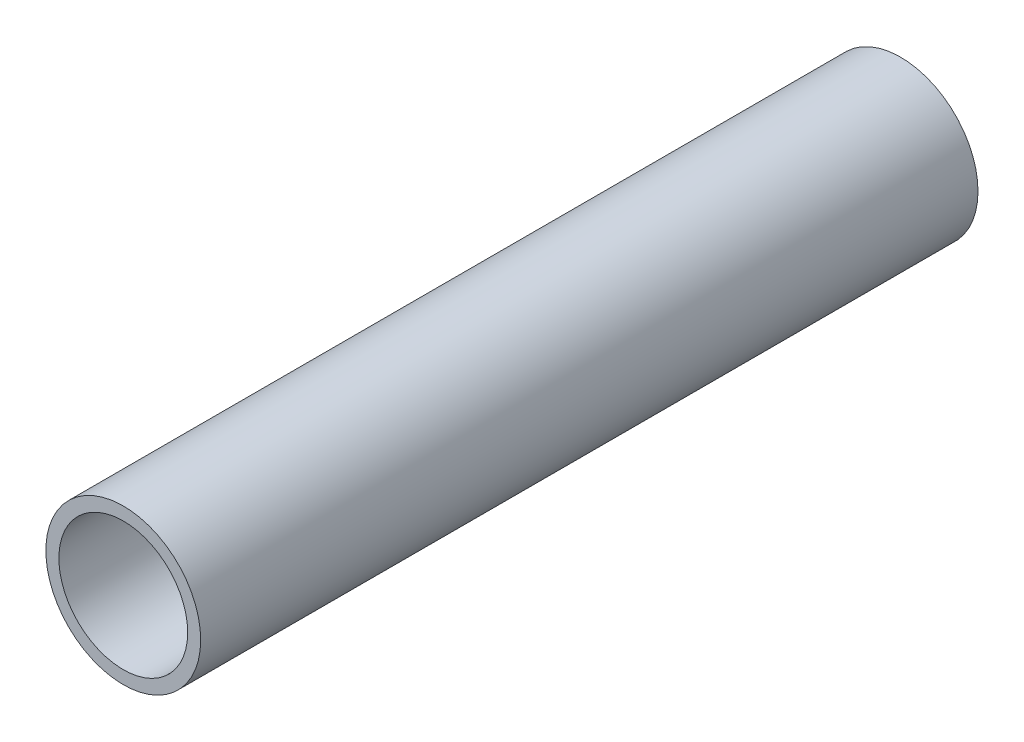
SolidWorks part; units mm, degrees
ref_plane "Plan de face" through (0, 0, 0) normal (0, 0, 1) x (1, 0, 0)
ref_plane "Plan de dessus" through (0, 0, 0) normal (0, 1, 0) x (1, 0, 0)
ref_plane "Plan de droite" through (0, 0, 0) normal (1, 0, 0) x (0, 0, -1)
sketch "Esquisse1" plane through (0, 0, 0) normal (0, 0, 1) x (1, 0, 0)
  circle A0 centre (0, 0) radius 2.975
  dimension "D1" = 5.95
extrude "Extrusion1" add sketch "Esquisse1" along normal blind 29.87
sketch "Esquisse2" plane through (0, 0, 29.87) normal (0, 0, 1) x (1, 0, 0)
  circle A1 centre (0, 0) radius 2.475
  dimension "D1" = 4.95
extrude "Enlèv. mat.-Extru.1" cut sketch "Esquisse2" against normal through all
